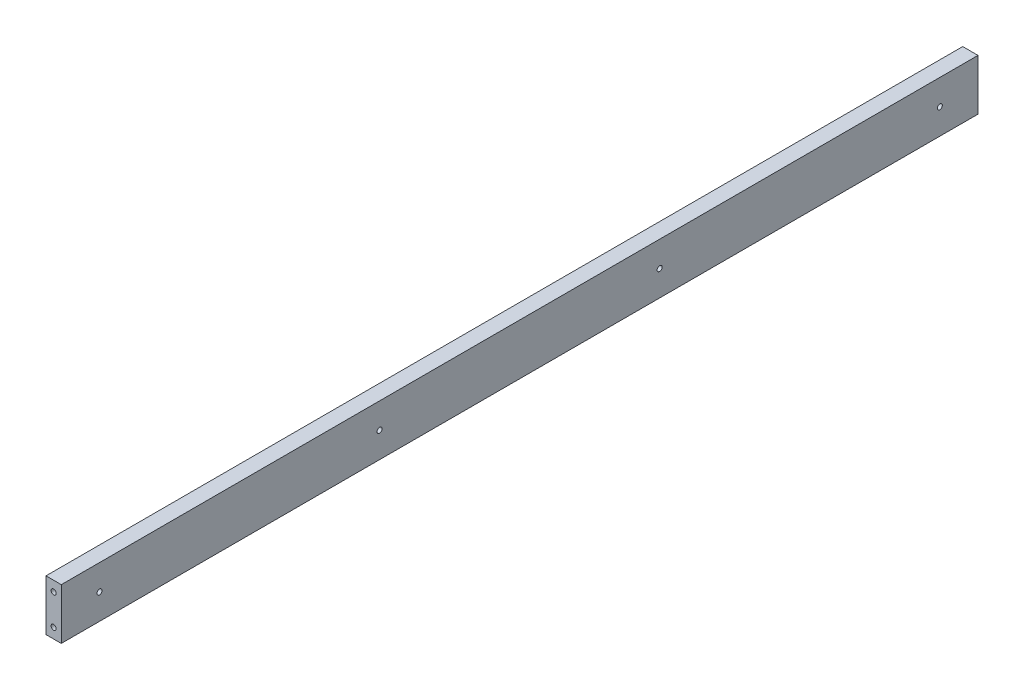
SolidWorks part; units mm, degrees
ref_plane "Plan de face" through (0, 0, 0) normal (0, 0, 1) x (1, 0, 0)
ref_plane "Plan de dessus" through (0, 0, 0) normal (0, 1, 0) x (1, 0, 0)
ref_plane "Plan de droite" through (0, 0, 0) normal (1, 0, 0) x (0, 0, -1)
sketch "Esquisse1" plane through (0, 0, 0) normal (0, 0, 1) x (1, 0, 0)
  line L1 (0, 0) -> (15, 0)
  line L2 (0, 0) -> (0, 50)
  line L3 (0, 50) -> (15, 50)
  line L4 (15, 0) -> (15, 50)
  dimension "D1" = 50
  dimension "D2" = 15
extrude "Extrusion1" add sketch "Esquisse1" against normal mid plane 900
hole_wizard "Trou taraudé M61" positions "Esquisse3" profile "Esquisse2" tap size "M6" standard "ISO"
sketch "Esquisse3" plane through (0, 0, 450) normal (0, 0, 1) x (1, 0, 0)
  line L0 (0, 50) -> (0, 0) construction
  line L1 (0, 0) -> (15, 0) construction
  point P0 (7.5, 40)
  point P1 (7.5, 10)
  dimension "D1" = 7.5
  dimension "D2" = 30
  dimension "D3" = 10
sketch "Esquisse2" plane through (7.5, 40, 450) normal (1, 0, 0) x (0, -1, 0)
  line L0 (0, 0) -> (0, 17.5022)
  line L1 (0, 17.5022) -> (2.5, 16)
  line L2 (2.5, 16) -> (2.5, 0)
  line L5 (2.5, 0) -> (0, 0)
  line L10 (0, 17.5022) -> (-2.5, 16) construction
  line L11 (0, -6.35) -> (0, 107.95) construction
  dimension "Diamètre du trou pour taraudage" = 5
  dimension "Profondeur du trou pour taraudage" = 16
  dimension "Angle de pointe" = 118
mirror "Symétrie1" about plane through (0, 0, 0) normal (0, 0, 1) of "Trou taraudé M61"
hole_wizard "Trou taraudé M62" positions "Esquisse5" profile "Esquisse4" tap size "M6" standard "ISO"
sketch "Esquisse5" plane through (15, 0, 0) normal (1, 0, 0) x (0, 0, -1)
  line L0 (450, 0) -> (-450, 0) construction
  line L1 (-450, 0) -> (-450, 50) construction
  point P0 (137.5, 25)
  point P1 (-412.5, 25)
  point P3 (-137.5, 25)
  point P14 (412.5, 25)
  dimension "D1" = 37.5
  dimension "D3" = 25
sketch "Esquisse4" plane through (15, 25, -137.5) normal (0, 1, 0) x (0, 0, -1)
  line L0 (0, 0) -> (0, 15)
  line L1 (0, 15) -> (2.5, 15)
  line L2 (2.5, 15) -> (2.5, 0)
  line L5 (2.5, 0) -> (0, 0)
  line L11 (0, -6.35) -> (0, 107.95) construction
  dimension "Diamètre du trou pour taraudage jusqu'au prochain" = 5
  dimension "Profondeur du trou pour taraudage jusqu'au prochain" = 15
